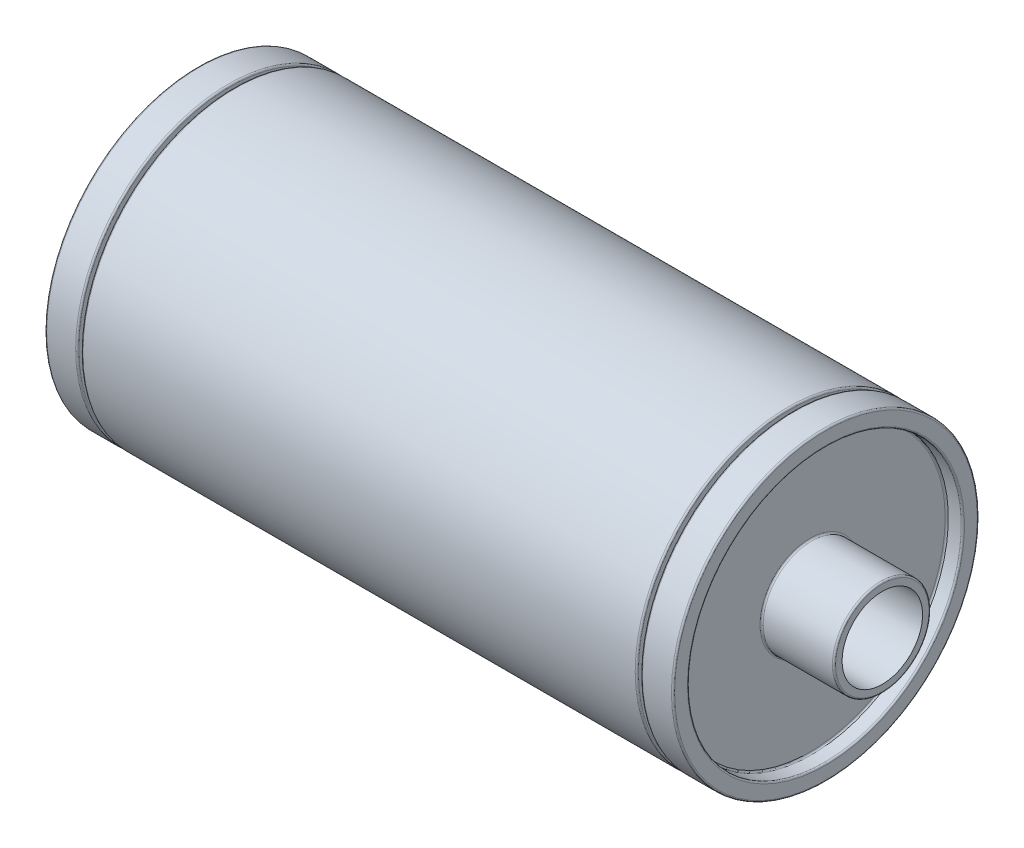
SolidWorks part; units mm, degrees
ref_plane "Plan1" through (0, 0, 0) normal (0, 0, 1) x (1, 0, 0)
ref_plane "Plan2" through (0, 0, 0) normal (0, 1, 0) x (1, 0, 0)
ref_plane "Plan3" through (0, 0, 0) normal (1, 0, 0) x (0, 0, -1)
sketch "Esquisse1" plane through (0, 0, 0) normal (0, 0, 1) x (1, 0, 0)
  line L0 (-72.4264, 0) -> (93.3242, 0) construction
  line L1 (-23, 2.5) -> (23, 2.5)
  line L2 (-23, 2.5) -> (-23, 3)
  line L3 (-23, 3) -> (-18.5, 3)
  line L4 (-18.5, 3) -> (-18.5, 8.5)
  line L5 (-18.5, 8.5) -> (-19.5, 8.5)
  line L6 (-19.5, 8.5) -> (-19.5, 9.5)
  line L7 (-19.5, 9.5) -> (-17.5, 9.5)
  line L8 (-17.5, 9.5) -> (-17.5, 9)
  line L9 (-17.5, 9) -> (-17.25, 9)
  line L10 (-17.25, 9) -> (-17.25, 9.5)
  line L11 (-17.25, 9.5) -> (17.25, 9.5)
  line L13 (17.25, 9) -> (17.25, 9.5)
  line L14 (17.5, 9) -> (17.25, 9)
  line L15 (17.5, 9.5) -> (17.5, 9)
  line L16 (19.5, 9.5) -> (17.5, 9.5)
  line L17 (19.5, 8.5) -> (19.5, 9.5)
  line L18 (18.5, 8.5) -> (19.5, 8.5)
  line L19 (18.5, 3) -> (18.5, 8.5)
  line L20 (23, 3) -> (18.5, 3)
  line L21 (23, 2.5) -> (23, 3)
  point P18 (0, 9.5)
  dimension "D1" = 5
  dimension "D2" = 46
  dimension "D3" = 23
  dimension "D4" = 0.5
  dimension "D5" = 19
  dimension "D6" = 1
  dimension "D7" = 1
  dimension "D8" = 19.5
  dimension "D9" = 2
  dimension "D10" = 0.25
  dimension "D11" = 0.5
  dimension "D12" = 9.5
  dimension "D13" = 6
  dimension "D14" = 4.5
  dimension "D15" = 5.5
  dimension "D16" = 1
  dimension "D17" = 2
  dimension "D18" = 1
  dimension "D19" = 0.5
  dimension "D20" = 0.25
revolve "Révolution1" add sketch "Esquisse1" angle 360 about L0
fillet "Congé1" radius 0.1
